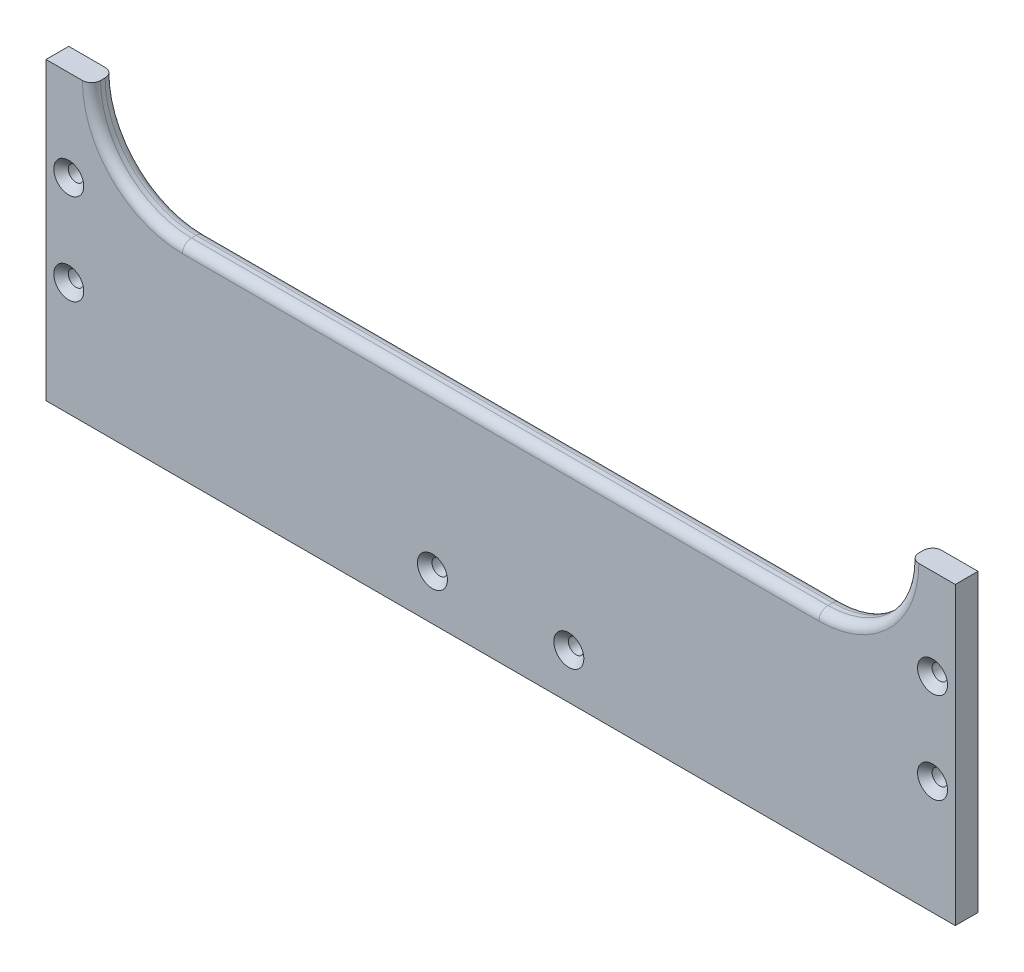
SolidWorks part; units mm, degrees
ref_plane "前视基准面" through (0, 0, 0) normal (0, 0, 1) x (1, 0, 0)
ref_plane "上视基准面" through (0, 0, 0) normal (0, 1, 0) x (1, 0, 0)
ref_plane "右视基准面" through (0, 0, 0) normal (1, 0, 0) x (0, 0, -1)
other "Configuration Table"
sketch "草图1" plane through (0, 0, 0) normal (0, 0, 1) x (1, 0, 0)
  line L1 (-100, 40) -> (100, 40)
  line L2 (-100, 40) -> (-100, -40)
  line L3 (-100, -40) -> (100, -40)
  line L4 (100, 40) -> (100, -40)
  line L5 (-100, 40) -> (100, -40) construction
  line L6 (-100, -40) -> (100, 40) construction
  point P0 (0, 0)
  dimension "D1" = 200
  dimension "D2" = 80
extrude "凸台-拉伸1" add sketch "草图1" along normal blind 5
hole_wizard "M3 十字槽沉头木螺钉的锥形沉头孔1" positions "草图2" profile "草图3" countersink size "M3" standard "GB"
sketch "草图2" plane through (0, 0, 5) normal (0, 0, 1) x (1, 0, 0)
  line L0 (-100, -40) -> (100, -40) construction
  line L2 (-100, 40) -> (-100, -40) construction
  line L3 (100, -40) -> (100, 40) construction
  point P0 (-15, -30)
  point P4 (15, -30)
  point P6 (-95, -15)
  point P8 (-95, 5)
  point P10 (95, 5)
  point P12 (95, -15)
  dimension "D1" = 25
  dimension "D2" = 20
  dimension "D3" = 25
  dimension "D4" = 20
  dimension "D5" = 10
  dimension "D6" = 85
  dimension "D7" = 10
  dimension "D8" = 85
  dimension "D9" = 5
  dimension "D10" = 5
  dimension "D11" = 5
  dimension "D12" = 5
sketch "草图3" plane through (-15, -30, 5) normal (1, 0, 0) x (0, -1, 0)
  line L0 (0, 0) -> (0, 15.0215)
  line L1 (0, 15.0215) -> (1.7, 14)
  line L2 (1.7, 14) -> (1.7, 1.6)
  line L3 (1.7, 1.6) -> (3.3, 0)
  line L5 (3.3, 0) -> (0, 0)
  line L6 (-1.7, 1.6) -> (-3.3, 0) construction
  line L10 (0, 15.0215) -> (-1.7, 14) construction
  line L11 (0, -6.35) -> (0, 107.95) construction
  dimension "孔直径" = 3.4
  dimension "孔深度" = 14
  dimension "近端锥形沉头孔直径" = 6.6
  dimension "近端锥形沉头孔角度" = 90
  dimension "导头角度" = 118
sketch "草图4" plane through (0, 40, 0) normal (0, 1, 0) x (1, 0, 0)
  line L4 (100, 0) -> (-100, 0)
  line L5 (-100, 0) -> (-100, -5)
  line L6 (-100, -5) -> (100, -5)
  line L7 (100, -5) -> (100, 0)
  line L8 (100, 0) -> (-100, 0)
  line L9 (-100, 0) -> (-100, -5)
  line L10 (-100, -5) -> (100, -5)
  line L11 (100, -5) -> (100, 0)
  dimension "D1" = 0
extrude "切除-拉伸1" cut sketch "草图4" against normal blind 15
sketch "草图5" plane through (0, 0, 5) normal (0, 0, 1) x (1, 0, 0)
  line L0 (-70, 25) -> (70, 25) construction
  line L1 (-100, 25) -> (100, 25) construction
  line L2 (-70, 45) -> (70, 45)
  line L3 (-70, 5) -> (70, 5)
  line L4 (-100, 25) -> (-100, -40) construction
  line L5 (100, -40) -> (100, 25) construction
  arc A0 (-70, 45) -> (-70, 5) centre (-70, 25) ccw
  arc A1 (70, 5) -> (70, 45) centre (70, 25) ccw
  point P4 (0, 25)
  dimension "D3" = 20
  dimension "D1" = 30
  dimension "D2" = 30
extrude "切除-拉伸2" cut sketch "草图5" against normal blind 10
fillet "圆角1" radius 2 3 edges at (-84.1421, 10.8579, 5) (84.1421, 10.8579, 5) (0, 5, 5)
fillet "圆角2" radius 2 3 edges at (-84.1421, 10.8579, 0) (84.1421, 10.8579, 0) (0, 5, 0)
